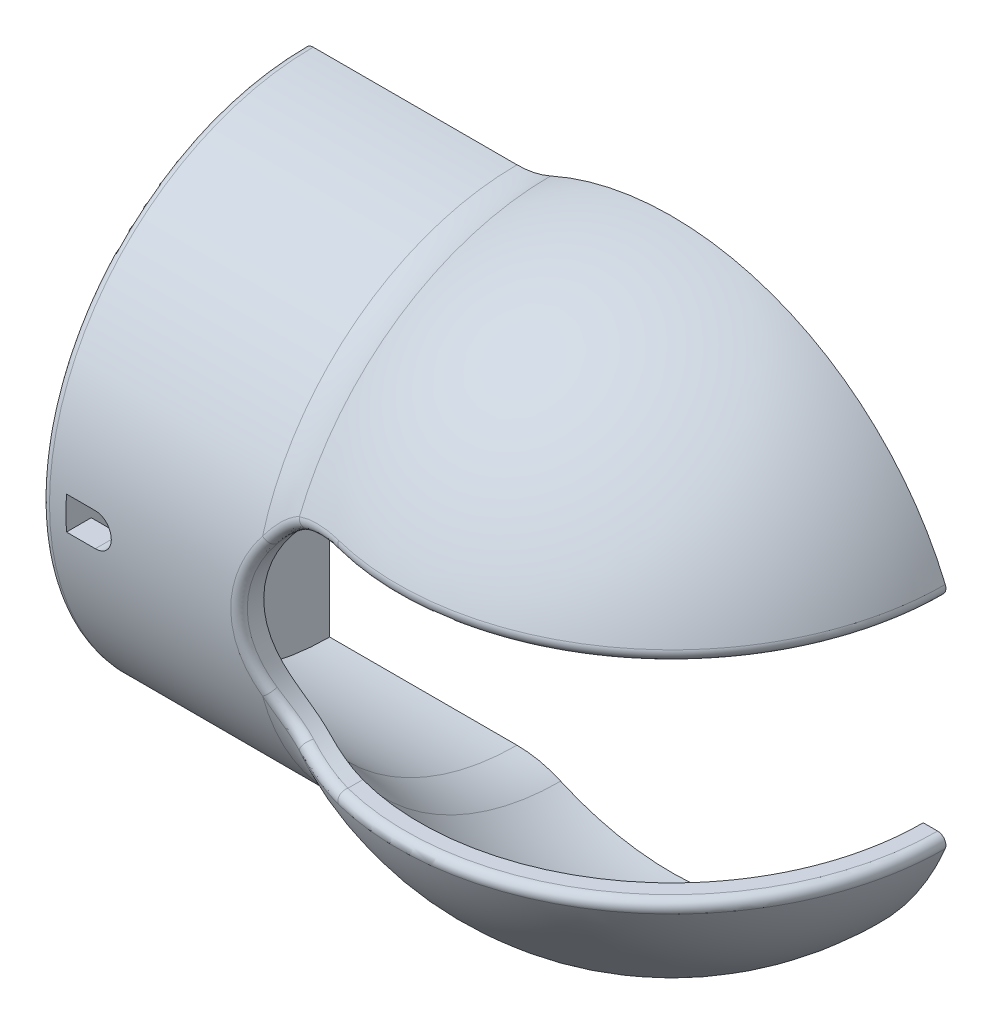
SolidWorks part; units mm, degrees
ref_plane "Plan de face" through (0, 0, 0) normal (0, 0, 1) x (1, 0, 0)
ref_plane "Plan de dessus" through (0, 0, 0) normal (0, 1, 0) x (1, 0, 0)
ref_plane "Plan de droite" through (0, 0, 0) normal (1, 0, 0) x (0, 0, -1)
imported_body "Stock-Coque de base-1"
sketch "Esquisse1" plane through (0, 0, 0) normal (0, 0, -1) x (-1, 0, 0)
  line L0 (0, 0) -> (-48.9727, 0) construction
  line L1 (-33.7602, -12.5) -> (8, -12.5)
  line L2 (8, 12.5) -> (-33.7602, 12.5)
  arc A0 (8, -12.5) -> (8, 12.5) centre (8, 0) ccw
  arc A1 (14.683, 32.8696) -> (14.683, -32.8696) centre (0, 0) ccw construction
  arc A2 (-33.7602, 12.5) -> (-33.7602, -12.5) centre (0, 0) ccw
  dimension "D1" = 8
  dimension "D2" = 25
extrude "Enlèv. mat.-Extru.1" cut sketch "Esquisse1" against normal through all
fillet "Congé1" radius 1 1 edges at (-44.5, 0, 32)
fillet "Congé2" radius 1 7 edges at (20.8527, -12.5, 26.5502) (-12.2353, -11.7606, 31.7488) (-16.655, 9.0189, 30.9366) (-17.1663, -8.4988, 30.9836) (-20.4204, 1.4081, 31.969) (-10.6993, 12.2051, 32.1335) (20.8527, 12.5, 26.5502)
sketch "Esquisse2" plane through (0, 0, 0) normal (0, 0, -1) x (-1, 0, 0)
  line L0 (41.5, -29) -> (41.5, 29) construction
  line L1 (41.5, -2) -> (41.5, 2)
  line L2 (41.5, -2) -> (38, -2)
  line L3 (38, 2) -> (41.5, 2)
  arc A0 (38, -2) -> (38, 2) centre (38, 0) cw
  dimension "D1" = 2
  dimension "D2" = 3.5
extrude "Enlèv. mat.-Extru.2" cut sketch "Esquisse2" against normal through all
